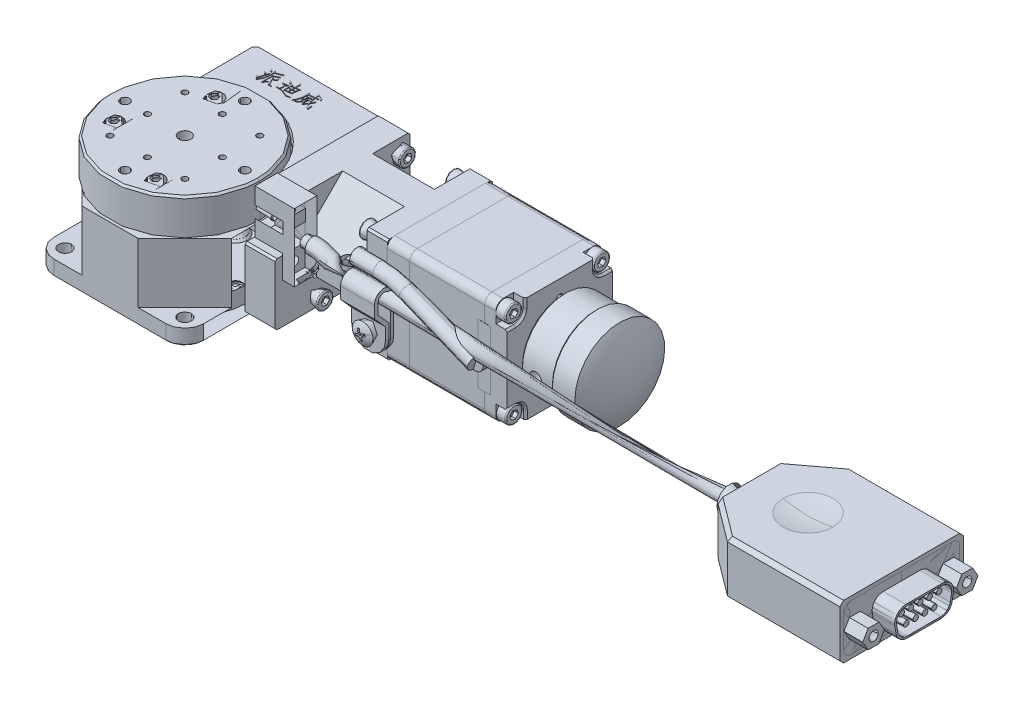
SolidWorks part; units mm, degrees
ref_plane "前视基准面" through (0, 0, 0) normal (0, 0, 1) x (1, 0, 0)
ref_plane "上视基准面" through (0, 0, 0) normal (0, 1, 0) x (1, 0, 0)
ref_plane "右视基准面" through (0, 0, 0) normal (1, 0, 0) x (0, 0, -1)
imported_body "曲面-输入1"
imported_body "曲面-输入2"
imported_body "曲面-输入3"
imported_body "曲面-输入4"
imported_body "曲面-输入5"
imported_body "曲面-输入6"
imported_body "曲面-输入7"
imported_body "曲面-输入8"
imported_body "输入1"
imported_body "曲面-输入9"
imported_body "输入2"
imported_body "曲面-输入10"
imported_body "曲面-输入11"
imported_body "曲面-输入12"
imported_body "曲面-输入13"
imported_body "曲面-输入14"
imported_body "曲面-输入15"
imported_body "曲面-输入16"
imported_body "曲面-输入17"
imported_body "曲面-输入18"
sketch "草图2" plane through (0, 28.5, 0) normal (0, 1, 0) x (1, 0, 0)
  text T0 "派迪威"
extrude "凸台-拉伸1" add sketch "草图2" along normal blind 0.121 separate body
